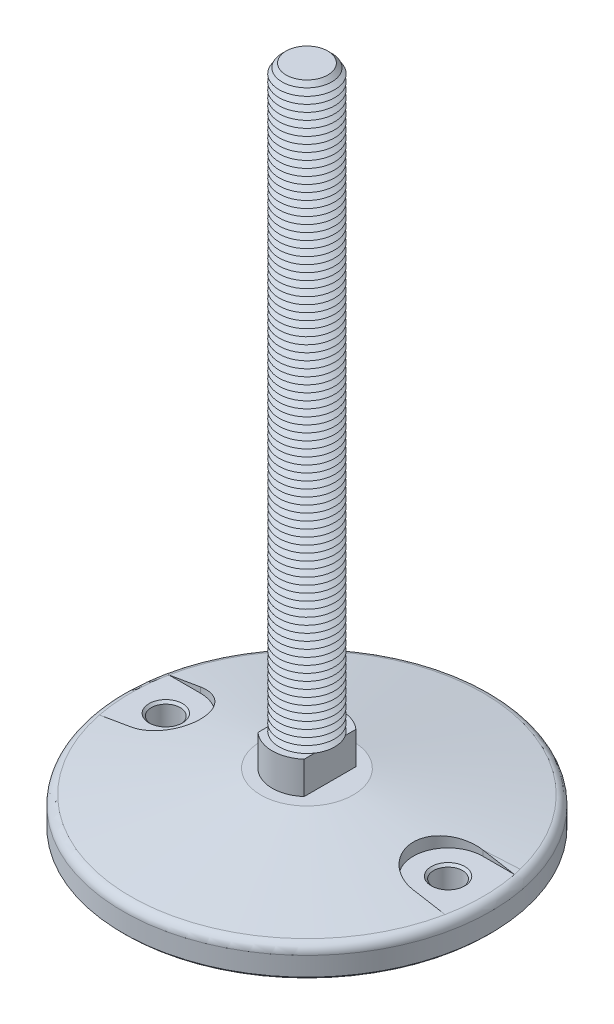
SolidWorks part; units mm, degrees
ref_plane "Front Plane" through (0, 0, 0) normal (0, 0, 1) x (1, 0, 0)
ref_plane "Top Plane" through (0, 0, 0) normal (0, 1, 0) x (1, 0, 0)
ref_plane "Right Plane" through (0, 0, 0) normal (1, 0, 0) x (0, 0, -1)
sketch "Sketch1" plane through (0, 0, 0) normal (1, 0, 0) x (0, 0, -1)
  line L0 (0, 61.3389) -> (0, -58.404) construction
sketch "Sketch2" plane through (0, 0, 0) normal (1, 0, 0) x (0, 0, -1)
  line L0 (0, 0) -> (-20, 0)
  line L1 (-20, 0) -> (-79.5, -10.4915)
  line L2 (-79.5, -10.4915) -> (-79.5, -23)
  line L3 (-79.5, -23) -> (0, -23)
  line L4 (0, 61.3389) -> (0, -58.404) construction
  line L5 (0, -23) -> (0, 0)
  dimension "D1" = 23
  dimension "D2" = 79.5
  dimension "D3" = 20
  dimension "D4" = 10
revolve "Revolve1" add sketch "Sketch2" angle 360 about L0
fillet "Fillet1" radius 4 1 edges at (0, -10.4915, 79.5)
sketch "Sketch3" plane through (0, 0, 0) normal (0, 1, 0) x (1, 0, 0)
  circle A0 centre (0, 0) radius 15
  dimension "D1" = 30
extrude "Boss-Extrude1" add sketch "Sketch3" along normal blind 14
sketch "Sketch4" plane through (0, 14, 0) normal (0, 1, 0) x (1, 0, 0)
  line L0 (-10, 11.1803) -> (-10, -11.1803)
  line L2 (10, -11.1803) -> (10, 11.1803)
  arc A0 (-10, 11.1803) -> (-10, -11.1803) centre (0, 0) ccw
  circle A1 centre (0, 0) radius 15 construction
  arc A2 (10, -11.1803) -> (10, 11.1803) centre (0, 0) ccw
  dimension "D1" = 20
extrude "Cut-Extrude1" cut sketch "Sketch4" against normal blind 14
sketch "Sketch5" plane through (0, 14, 0) normal (0, 1, 0) x (1, 0, 0)
  circle A0 centre (0, 0) radius 12
  dimension "D1" = 24
extrude "Boss-Extrude2" add sketch "Sketch5" along normal blind 250
chamfer "Chamfer1" distance 3 angle 45 1 edges at (0, 264, 12)
sketch "Sketch6" plane through (0, 0, 0) normal (1, 0, 0) x (0, 0, -1)
  line L0 (-12, 14) -> (-9.4019, 15.5)
  line L1 (-9.4019, 15.5) -> (-12, 17)
  line L2 (-12, 261) -> (-12, 14) construction
  line L3 (-12, 17) -> (-12, 14)
  dimension "D1" = 3
revolve "Cut-Revolve1" cut sketch "Sketch6" angle 360 about L0
pattern_linear "LPattern1" count 83 spacing 3 along (0, 1, 0) of "Cut-Revolve1"
sketch "Sketch8" plane through (0, 0, 0) normal (0, 1, 0) x (1, 0, 0)
  line L0 (-61, 15) -> (-74.7035, 15)
  line L1 (-61, -15) -> (-74.7035, -15)
  arc A1 (-74.7035, 15) -> (-74.7035, -15) centre (0, 0) ccw
  circle A2 centre (0, 0) radius 76.1946 construction
  arc A3 (-61, -15) -> (-61, 15) centre (-61, 0) ccw
  point P3 (-61, 0)
  point P11 (0, 0)
  dimension "D1" = 61
  dimension "D2" = 30
extrude "Cut-Extrude4" cut sketch "Sketch8" against normal blind 9.91
sketch "Sketch10" plane through (0, -9.91, 0) normal (0, 1, 0) x (1, 0, 0)
  circle A0 centre (-61, 0) radius 6.25
  dimension "D1" = 12.5
extrude "Cut-Extrude5" cut sketch "Sketch10" against normal up to surface (13.09 mm away)
chamfer "Chamfer2" distance 1 angle 45 2 edges at (-61, -23, -6.25) (-61, -9.91, 6.25)
mirror "Mirror1" about plane through (0, 0, 0) normal (1, 0, 0) of "Chamfer2", "Cut-Extrude5", "Cut-Extrude4"
chamfer "Chamfer3" distance 1 angle 45 1 edges at (0, -23, 79.5)
